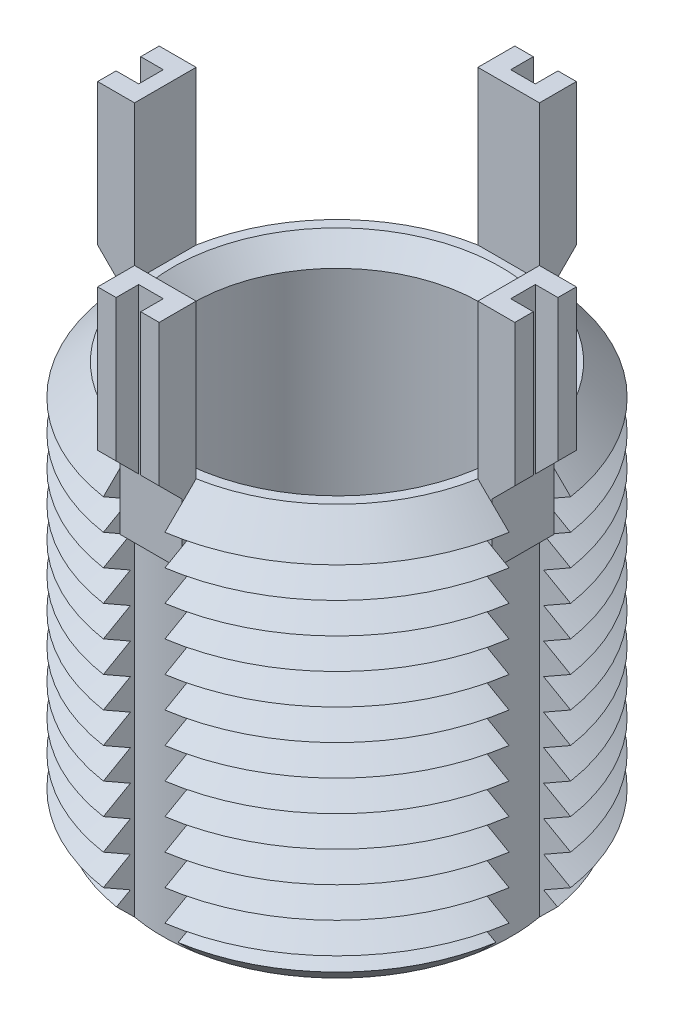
SolidWorks part; units mm, degrees
ref_plane "Front Plane" through (0, 0, 0) normal (0, 0, 1) x (1, 0, 0)
ref_plane "Top Plane" through (0, 0, 0) normal (0, 1, 0) x (1, 0, 0)
ref_plane "Right Plane" through (0, 0, 0) normal (1, 0, 0) x (0, 0, -1)
sketch "Sketch1" plane through (0, 0, 0) normal (0, 1, 0) x (1, 0, 0)
  circle A0 centre (0, 0) radius 10
  dimension "D1" = 20
extrude "Boss-Extrude1" add sketch "Sketch1" against normal blind 20
chamfer "Chamfer1" distance 1.5 angle 45 2 edges at (0, -20, 10) (0, 0, 10)
sketch "Sketch2" plane through (0, 0, 0) normal (1, 0, 0) x (0, 0, -1)
  line L0 (0, 0.8859) -> (0, -9.2617) construction
sketch "Sketch3" plane through (0, 0, 0) normal (1, 0, 0) x (0, 0, -1)
  line L0 (-10, -1.5) -> (-8.701, -2.25)
  line L1 (-8.701, -2.25) -> (-10, -3)
  line L2 (-10, -1.5) -> (-10, -18.5) construction
  line L3 (-10, -3) -> (-10, -1.5)
  dimension "D1" = 1.5
revolve "Cut-Revolve1" cut sketch "Sketch3" angle 360 about L0
pattern_linear "LPattern1" count 12 spacing 1.5 along (0, -1, 0) of "Cut-Revolve1"
sketch "Sketch4" plane through (0, 0, 0) normal (0, 1, 0) x (1, 0, 0)
  line L0 (-8.3666, 1.5) -> (-9.8869, 1.5)
  line L2 (-9.8869, -1.5) -> (-8.3666, -1.5)
  arc A0 (-8.3666, 1.5) -> (-8.3666, -1.5) centre (0, 0) ccw
  arc A1 (-9.8869, 1.5) -> (-9.8869, -1.5) centre (0, 0) ccw
  circle A2 centre (0, 0) radius 10 construction
  circle A3 centre (0, 0) radius 8.5 construction
  point P1 (-8.5, 0)
  point P3 (-10, 0)
  point P13 (0, 0)
  dimension "D1" = 3
extrude "Cut-Extrude1" cut sketch "Sketch4" against normal up to surface (20 mm away)
pattern_circular "CirPattern1" count 4 over 360 about axis through (0, 0, 0) along (0, 1, 0) of "Cut-Extrude1"
sketch "Sketch5" plane through (0, 0, 0) normal (1, 0, 0) x (0, 0, -1)
  line L0 (-8.3666, 7.5) -> (-8.3666, -3.5)
  line L1 (-8.3666, -3.5) -> (-9.0666, -3.5)
  line L2 (-9.0666, -3.5) -> (-9.0666, -0.5)
  line L3 (-9.0666, -0.5) -> (-10.1666, 0.6)
  line L4 (-10.1666, 0.6) -> (-10.1666, 7.5)
  line L5 (-10.1666, 7.5) -> (-8.3666, 7.5)
  line L6 (-9.8869, -4.5) -> (-1.5, -4.5) construction
  point P9 (-1.5, 0)
  point P10 (-9.0666, -0.5)
  dimension "D1" = 1
  dimension "D2" = 11
  dimension "D3" = 8
  dimension "D4" = 1.8
  dimension "D5" = 0.7
  dimension "D6" = 45
extrude "Boss-Extrude3" add sketch "Sketch5" along normal mid plane 3
pattern_circular "CirPattern2" count 4 over 360 about axis through (0, 0, 0) along (0, 1, 0) of "Boss-Extrude3"
sketch "Sketch6" plane through (0, 7.5, 0) normal (0, 1, 0) x (1, 0, 0)
  line L0 (-10.1666, -1.5) -> (-10.1666, 1.5) construction
  line L1 (-10.1666, -0.6) -> (-9.0666, -0.6)
  line L2 (-10.1666, -0.6) -> (-10.1666, 0.6)
  line L3 (-10.1666, 0.6) -> (-9.0666, 0.6)
  line L4 (-9.0666, -0.6) -> (-9.0666, 0.6)
  line L5 (-10.1666, -0.6) -> (-9.0666, 0.6) construction
  line L6 (-10.1666, 0.6) -> (-9.0666, -0.6) construction
  line L7 (10.1666, 1.5) -> (10.1666, -1.5) construction
  line L8 (-0.6, 9.0666) -> (0.6, 9.0666)
  line L9 (-0.6, 9.0666) -> (-0.6, 10.1666)
  line L10 (-0.6, 10.1666) -> (0.6, 10.1666)
  line L11 (0.6, 9.0666) -> (0.6, 10.1666)
  line L12 (-0.6, 9.0666) -> (0.6, 10.1666) construction
  line L13 (-0.6, 10.1666) -> (0.6, 9.0666) construction
  line L14 (9.0666, -0.6) -> (10.1666, -0.6)
  line L15 (9.0666, -0.6) -> (9.0666, 0.6)
  line L16 (9.0666, 0.6) -> (10.1666, 0.6)
  line L17 (10.1666, -0.6) -> (10.1666, 0.6)
  line L18 (9.0666, -0.6) -> (10.1666, 0.6) construction
  line L19 (9.0666, 0.6) -> (10.1666, -0.6) construction
  line L20 (-0.6, -10.1666) -> (0.6, -10.1666)
  line L21 (-0.6, -10.1666) -> (-0.6, -9.0666)
  line L22 (-0.6, -9.0666) -> (0.6, -9.0666)
  line L23 (0.6, -10.1666) -> (0.6, -9.0666)
  line L24 (-0.6, -10.1666) -> (0.6, -9.0666) construction
  line L25 (-0.6, -9.0666) -> (0.6, -10.1666) construction
  line L26 (-1.5, 10.1666) -> (1.5, 10.1666) construction
  line L27 (1.5, -10.1666) -> (-1.5, -10.1666) construction
  point P0 (-9.6166, 0)
  point P7 (-10.1666, 0)
  point P8 (-10.1666, 0)
  point P9 (0, 9.6166)
  point P14 (9.6166, 0)
  point P19 (0, -9.6166)
  point P24 (0, 10.1666)
  point P25 (10.1666, 0)
  point P26 (10.1666, 0)
  point P27 (0, 10.1666)
  point P30 (0, -10.1666)
  point P33 (0, -10.1666)
  dimension "D1" = 1.2
  dimension "D2" = 1.1
extrude "Cut-Extrude3" cut sketch "Sketch6" against normal through all both and the other way through all
sketch "Sketch7" plane through (0, 0, 0) normal (0, 1, 0) x (1, 0, 0)
  circle A0 centre (0, 0) radius 7
  dimension "D1" = 14
extrude "Cut-Extrude4" cut sketch "Sketch7" against normal up to surface (20 mm away)
chamfer "Chamfer2" distance 1 angle 45 2 edges at (0, 0, 7) (0, -20, 7)
